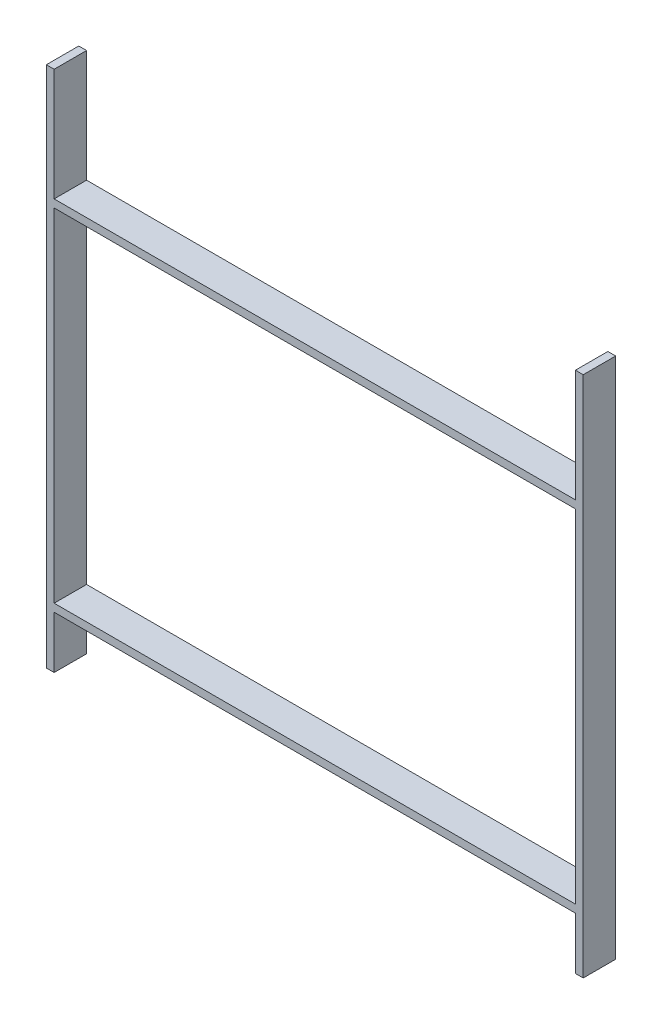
SolidWorks part; units mm, degrees
ref_plane "Plan de face" through (0, 0, 0) normal (0, 0, 1) x (1, 0, 0)
ref_plane "Plan de dessus" through (0, 0, 0) normal (0, 1, 0) x (1, 0, 0)
ref_plane "Plan de droite" through (0, 0, 0) normal (1, 0, 0) x (0, 0, -1)
sketch "Esquisse1" plane through (0, 0, 0) normal (0, 0, 1) x (1, 0, 0)
  line L0 (-223.5, 149) -> (223.5, 149)
  line L1 (-217, 142.5) -> (217, 142.5)
  line L2 (-217, 142.5) -> (-217, -142.5)
  line L3 (-217, -142.5) -> (217, -142.5)
  line L4 (217, 142.5) -> (217, -142.5)
  line L5 (223.5, 149) -> (223.5, -149)
  line L6 (-223.5, -149) -> (223.5, -149)
  line L7 (-223.5, 149) -> (-223.5, -149)
  dimension "D1" = 434
  dimension "D2" = 217
  dimension "D3" = 285
  dimension "D4" = 142.5
  dimension "D5" = 6.5
extrude "Boss.-Extru.1" add sketch "Esquisse1" along normal blind 27
sketch "Esquisse2" plane through (0, 0, 27) normal (0, 0, 1) x (1, 0, 0)
  line L1 (-217, 142.5) -> (-223.5, 142.5)
  line L2 (-217, 142.5) -> (-217, 242.5)
  line L3 (-217, 242.5) -> (-223.5, 242.5)
  line L4 (-223.5, 142.5) -> (-223.5, 242.5)
  line L5 (217, 142.5) -> (223.5, 142.5)
  line L6 (217, 142.5) -> (217, 242.5)
  line L7 (217, 242.5) -> (223.5, 242.5)
  line L8 (223.5, 142.5) -> (223.5, 242.5)
  line L9 (217, -142.5) -> (223.5, -142.5)
  line L10 (217, -142.5) -> (217, -192.5)
  line L11 (217, -192.5) -> (223.5, -192.5)
  line L12 (223.5, -142.5) -> (223.5, -192.5)
  line L13 (-217, -142.5) -> (-223.5, -142.5)
  line L14 (-217, -142.5) -> (-217, -192.5)
  line L15 (-217, -192.5) -> (-223.5, -192.5)
  line L16 (-223.5, -142.5) -> (-223.5, -192.5)
  dimension "D1" = 100
  dimension "D2" = 100
  dimension "D3" = 50
  dimension "D4" = 50
extrude "Boss.-Extru.2" add sketch "Esquisse2" against normal up to surface (27 mm away)
